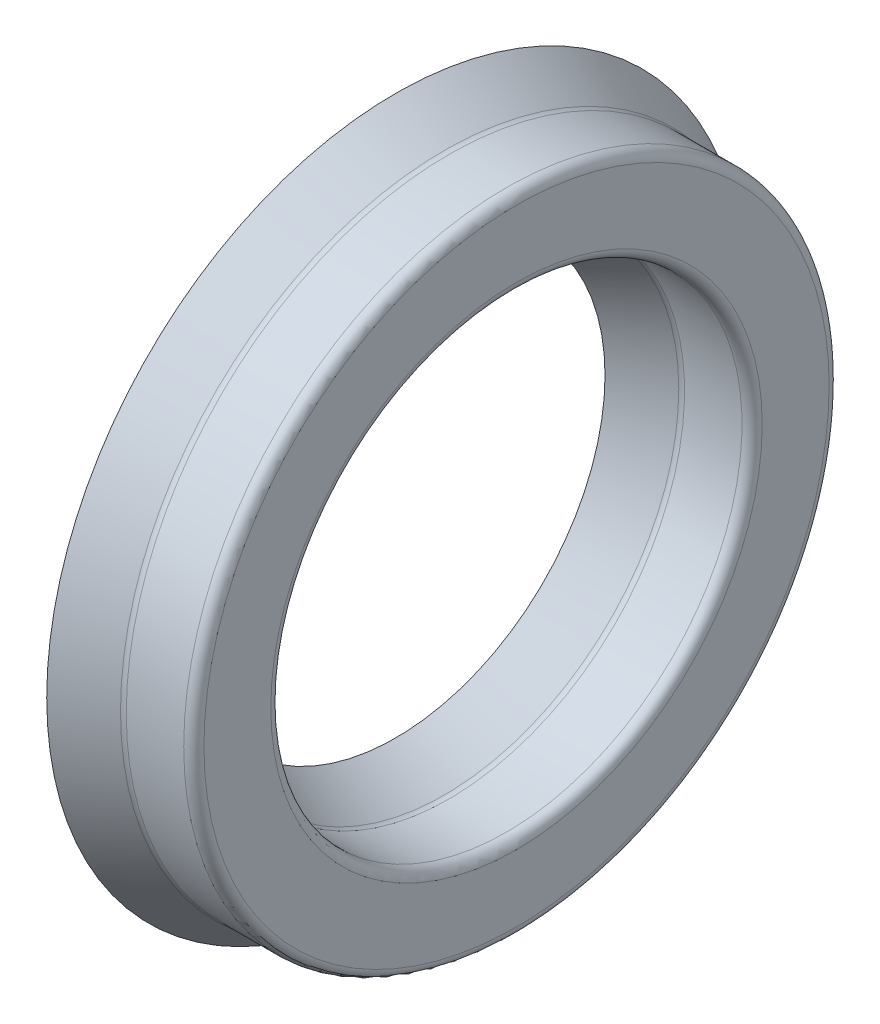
SolidWorks part; units mm, degrees
ref_plane "Front Plane" through (0, 0, 0) normal (0, 0, 1) x (1, 0, 0)
ref_plane "Top Plane" through (0, 0, 0) normal (0, 1, 0) x (1, 0, 0)
ref_plane "Right Plane" through (0, 0, 0) normal (1, 0, 0) x (0, 0, -1)
sketch "Sketch2" plane through (0, 0, 0) normal (0, 0, 1) x (1, 0, 0)
  line L0 (69.1667, 333) -> (345.8333, 333) construction
sketch "Sketch3" plane through (0, 0, 0) normal (0, 0, 1) x (1, 0, 0)
  line L0 (-1.1618, 7.9375) -> (-0.055, 7.3662)
  line L1 (0.0504, 7.3406) -> (1.3577, 7.3406)
  line L2 (1.5875, 7.1108) -> (1.5875, 5.5892)
  line L3 (1.3577, 5.3594) -> (0.0504, 5.3594)
  line L4 (-0.055, 5.3338) -> (-1.1618, 4.7625)
  line L5 (-1.1618, 4.7625) -> (-1.5875, 5.5872)
  line L6 (-1.5875, 5.5872) -> (-0.5054, 6.1458)
  line L7 (-0.5054, 6.5542) -> (-1.5875, 7.1128)
  line L8 (-1.5875, 7.1128) -> (-1.1618, 7.9375)
  line L9 (-1.5875, 0) -> (1.5875, 0) construction
  line L10 (-1.5875, 7.1128) -> (-1.5875, 5.5872) construction
  line L11 (-1.5875, 6.35) -> (1.5875, 6.35) construction
  line L13 (-1.1618, 7.9375) -> (-1.1618, 4.7625) construction
  line L14 (0.7041, 7.3406) -> (0.7041, 5.3594) construction
  arc A0 (0.0504, 5.3594) -> (-0.055, 5.3338) centre (0.0504, 5.1296) ccw
  arc A1 (-0.055, 7.3662) -> (0.0504, 7.3406) centre (0.0504, 7.5704) ccw
  arc A2 (-0.5054, 6.1458) -> (-0.5054, 6.5542) centre (-0.6108, 6.35) ccw
  arc A3 (1.5875, 5.5892) -> (1.3577, 5.3594) centre (1.3577, 5.5892) cw
  arc A4 (1.3577, 7.3406) -> (1.5875, 7.1108) centre (1.3577, 7.1108) cw
  point P24 (-0.381, 6.35)
revolve "Revolve1" add sketch "Sketch3" angle 360 about L9
equation "\"D4@Sketch3\"=(\"OD@Sketch3\"-\"ID@Sketch3\")*.312"
equation "\"D3@Sketch3\"=\"D4@Sketch3\"*.77"
equation "\"D2@Sketch3\"=\"Seal Width@Sketch3\"*.62"
equation "\"D1@Sketch3\"=\"D4@Sketch3\"*.116"
